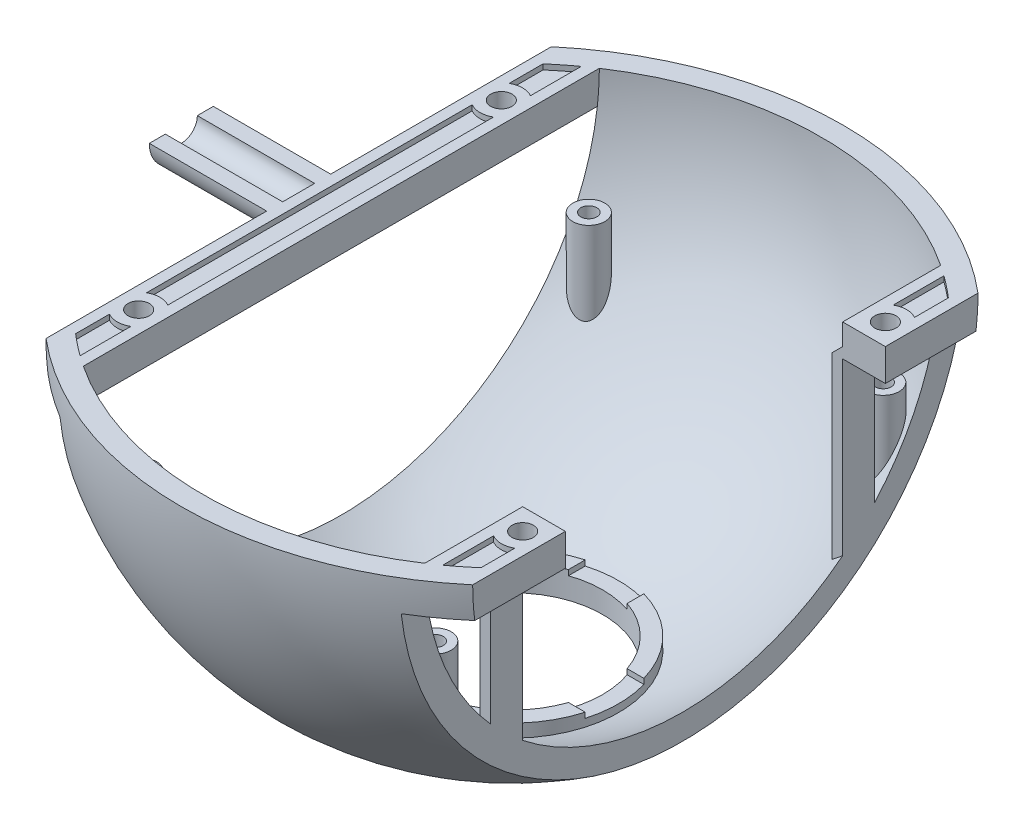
SolidWorks part; units mm, degrees
ref_plane "Plan de face" through (0, 0, 0) normal (0, 0, 1) x (1, 0, 0)
ref_plane "Plan de dessus" through (0, 0, 0) normal (0, 1, 0) x (1, 0, 0)
ref_plane "Plan de droite" through (0, 0, 0) normal (1, 0, 0) x (0, 0, -1)
imported_body "Stock-Base boitier-1"
ref_plane "Plan1" through (0, -13, 0) normal (0, 1, 0) x (-1, 0, 0)
sketch "Esquisse1" plane through (0, -13, 0) normal (0, 1, 0) x (-1, 0, 0)
  circle A0 centre (0, 20) radius 4
  circle A1 centre (0, 20) radius 3
  dimension "D1" = 8
  dimension "D2" = 20
  dimension "D3" = 1
extrude "Extrusion1" add sketch "Esquisse1" against normal up to next
sketch "Esquisse2" plane through (0, -13, 0) normal (0, 1, 0) x (-1, 0, 0)
  line L1 (0, 21.7321) -> (-1.5, 20.866) construction
  line L2 (-1.5, 20.866) -> (-1.5, 19.134) construction
  line L3 (-1.5, 19.134) -> (0, 18.2679) construction
  line L4 (0, 18.2679) -> (1.5, 19.134) construction
  line L5 (1.5, 19.134) -> (1.5, 20.866) construction
  line L6 (1.5, 20.866) -> (0, 21.7321) construction
  circle A0 centre (0, 20) radius 1.5 construction
  circle A1 centre (0, 20) radius 3 construction
  circle A2 centre (0, 20) radius 0.25
  circle A3 centre (-1.5, 20.866) radius 0.25
  circle A4 centre (-1.5, 19.134) radius 0.25
  circle A5 centre (0, 18.2679) radius 0.25
  circle A6 centre (1.5, 19.134) radius 0.25
  circle A7 centre (1.5, 20.866) radius 0.25
  circle A8 centre (0, 21.7321) radius 0.25
  dimension "D2" = 0.5
  dimension "D1" = 3
extrude "Enlèv. mat.-Extru.1" cut sketch "Esquisse2" against normal through all
ref_plane "Plan2" through (0, -26, 0) normal (0, 1, 0) x (-1, 0, 0)
sketch "Esquisse3" plane through (0, -26, 0) normal (0, 1, 0) x (-1, 0, 0)
  circle A0 centre (0, 0) radius 10
  circle A1 centre (0, 0) radius 8.5
  dimension "D1" = 20
  dimension "D2" = 1.5
extrude "Extrusion2" add sketch "Esquisse3" against normal up to next
sketch "Esquisse4" plane through (0, -26, 0) normal (0, 1, 0) x (-1, 0, 0)
  circle A0 centre (0, 0) radius 8.5 construction
  circle A1 centre (0, 0) radius 8.5
extrude "Enlèv. mat.-Extru.2" cut sketch "Esquisse4" against normal through all
sketch "Esquisse5" plane through (0, -26, 0) normal (0, 1, 0) x (-1, 0, 0)
  line L0 (0, 0) -> (0, 12.9162) construction
  line L1 (0, 0) -> (-11.4646, 0) construction
  line L2 (-9.6144, -2.75) -> (-8.0429, -2.75)
  line L3 (-9.6144, 2.75) -> (-8.0429, 2.75)
  line L4 (-2.75, -9.6144) -> (-2.75, -8.0429)
  line L5 (2.75, -9.6144) -> (2.75, -8.0429)
  line L6 (8.0429, -2.75) -> (9.6144, -2.75)
  line L7 (8.0429, 2.75) -> (9.6144, 2.75)
  line L8 (-2.75, 8.0429) -> (-2.75, 9.6144)
  line L9 (2.75, 8.0429) -> (2.75, 9.6144)
  circle A0 centre (0, 0) radius 8.5 construction
  circle A1 centre (0, 0) radius 10
  arc A2 (-2.75, -9.6144) -> (2.75, -9.6144) centre (0, 0) ccw
  arc A3 (-2.75, -8.0429) -> (2.75, -8.0429) centre (0, 0) ccw
  arc A4 (-9.6144, 2.75) -> (-9.6144, -2.75) centre (0, 0) ccw
  arc A5 (-8.0429, 2.75) -> (-8.0429, -2.75) centre (0, 0) ccw
  arc A6 (2.75, 8.0429) -> (-2.75, 8.0429) centre (0, 0) ccw
  arc A7 (2.75, 9.6144) -> (-2.75, 9.6144) centre (0, 0) ccw
  arc A8 (9.6144, -2.75) -> (9.6144, 2.75) centre (0, 0) ccw
  arc A9 (8.0429, -2.75) -> (8.0429, 2.75) centre (0, 0) ccw
  dimension "D2" = 5.5
  dimension "D3" = 5.5
  dimension "D1" = 0
extrude "Enlèv. mat.-Extru.3" cut sketch "Esquisse5" against normal blind 0.5
ref_plane "Plan3" through (0, -31, 0) normal (0, 1, 0) x (-1, 0, 0)
sketch "Esquisse6" plane through (0, -31, 0) normal (0, 1, 0) x (-1, 0, 0)
  circle A0 centre (0, 0) radius 10
  circle A1 centre (0, 0) radius 10 construction
extrude "Enlèv. mat.-Extru.4" cut sketch "Esquisse6" along normal offset from surface (2.5 mm away) 2.5
fillet "Congé2" radius 0.2 1 edges at (0, -29.3428, 10)
sketch "Esquisse7" plane through (0, -9, 0) normal (0, -1, 0) x (1, 0, 0)
  line L0 (0, 0) -> (22.544, 0) construction
  line L1 (0, 0) -> (0, 14.2479) construction
  circle A0 centre (-13.8, 21) radius 1.5
  circle A1 centre (13.8, 21) radius 1.5
  circle A2 centre (13.8, -21) radius 1.5
  circle A3 centre (-13.8, -21) radius 1.5
  dimension "D1" = 3
  dimension "D2" = 21
  dimension "D3" = 13.8
extrude "Extrusion3" add sketch "Esquisse7" along normal up to surface (6.7705 mm away)
sketch "Esquisse8" plane through (0, -9, 0) normal (0, 1, 0) x (-1, 0, 0)
  circle A0 centre (-13.8, 21) radius 0.75
  dimension "D1" = 1.5
extrude "Enlèv. mat.-Extru.5" cut sketch "Esquisse8" against normal blind 6
mirror "Symétrie1" about plane through (0, 0, 0) normal (0, 0, 1) of "Enlèv. mat.-Extru.5"
mirror "Symétrie2" about plane through (0, 0, 0) normal (1, 0, 0) of "Symétrie1", "Enlèv. mat.-Extru.5"
